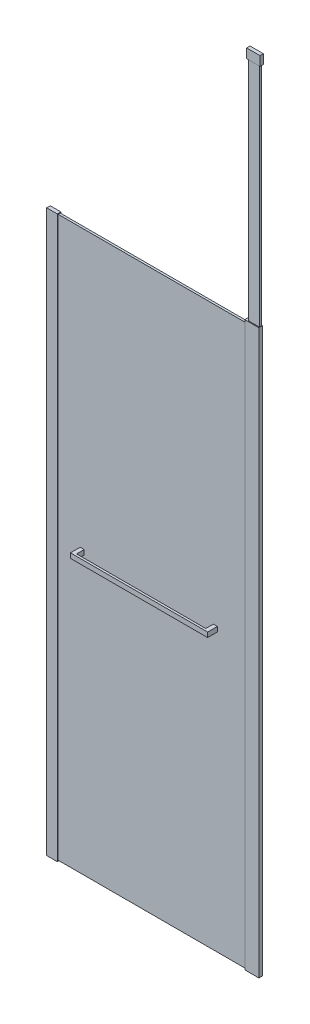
SolidWorks part; units mm, degrees
ref_plane "Płaszczyzna przednia" through (0, 0, 0) normal (0, 0, 1) x (1, 0, 0)
ref_plane "Płaszczyzna górna" through (0, 0, 0) normal (0, 1, 0) x (1, 0, 0)
ref_plane "Płaszczyzna prawa" through (0, 0, 0) normal (1, 0, 0) x (0, 0, -1)
sketch "Szkic1" plane through (0, 0, 0) normal (0, 1, 0) x (1, 0, 0)
  line L0 (0, 0) -> (0, 13.3)
  line L1 (0, 13.3) -> (40, 13.3)
  line L2 (40, 13.3) -> (40, 11.4)
  line L3 (40, 11.4) -> (6.5, 11.4)
  line L4 (6.5, 11.4) -> (6.5, 3.4)
  line L5 (6.5, 3.4) -> (40, 3.4)
  line L6 (40, 3.4) -> (40, 0)
  line L7 (40, 0) -> (0, 0)
  dimension "D1" = 40
  dimension "D2" = 13.3
  dimension "D3" = 33.5
  dimension "D4" = 1.9
  dimension "D5" = 8
extrude "Dodanie-wyciągnięcie1" add sketch "Szkic1" along normal blind 2100 from offset 3
sketch "Szkic2" plane through (0, 3, 0) normal (0, -1, 0) x (1, 0, 0)
  line L0 (6.5, -11.4) -> (40, -11.4) construction
  line L1 (6.5, -3.4) -> (753.5, -3.4)
  line L2 (6.5, -3.4) -> (6.5, -11.4)
  line L3 (6.5, -11.4) -> (753.5, -11.4)
  line L4 (753.5, -3.4) -> (753.5, -11.4)
  dimension "D1" = 747
extrude "Dodanie-wyciągnięcie2" add sketch "Szkic2" against normal blind 2100 separate body
sketch "Szkic3" plane through (0, 3, 0) normal (0, -1, 0) x (1, 0, 0)
  line L0 (743.4, -3.4) -> (743.4, -0.4)
  line L1 (753.5, -3.4) -> (6.5, -3.4) construction
  line L2 (743.4, -0.4) -> (796.4, -0.4)
  line L3 (796.4, -0.4) -> (796.4, -14.4)
  line L4 (796.4, -14.4) -> (743.4, -14.4)
  line L5 (743.4, -14.4) -> (743.4, -11.4)
  line L6 (743.4, -11.4) -> (753.5, -11.4)
  line L7 (753.5, -11.4) -> (753.5, -3.4)
  line L8 (753.5, -3.4) -> (743.4, -3.4)
  line L9 (6.5, -11.4) -> (753.5, -11.4) construction
  line L10 (753.5, -11.4) -> (753.5, -3.4) construction
  dimension "D1" = 10.1
  dimension "D2" = 3
  dimension "D3" = 3
  dimension "D4" = 53
extrude "Dodanie-wyciągnięcie3" add sketch "Szkic3" against normal blind 2108 separate body
sketch "Szkic4" plane through (0, 2103, 0) normal (0, 1, 0) x (1, 0, 0)
  line L1 (0, 13.3) -> (40, 13.3)
  line L2 (0, 13.3) -> (0, 0)
  line L3 (0, 0) -> (40, 0)
  line L4 (40, 13.3) -> (40, 0)
extrude "Dodanie-wyciągnięcie4" add sketch "Szkic4" along normal blind 3
sketch "Szkic5" plane through (0, 2111, 0) normal (0, 1, 0) x (1, 0, 0)
  line L1 (796.4, 14.4) -> (743.4, 14.4)
  line L2 (796.4, 14.4) -> (796.4, 0.4)
  line L3 (796.4, 0.4) -> (743.4, 0.4)
  line L4 (743.4, 14.4) -> (743.4, 0.4)
extrude "Dodanie-wyciągnięcie5" add sketch "Szkic5" along normal blind 3
sketch "Szkic6" plane through (743.4, 0, 0) normal (-1, 0, 0) x (0, 0, 1)
  line L0 (-11.4, 2111) -> (-3.4, 2111) construction
  line L1 (-3.35, 2111) -> (-11.45, 2111)
  line L2 (-3.35, 2111) -> (-3.35, 2103.2)
  line L3 (-3.35, 2103.2) -> (-11.45, 2103.2)
  line L4 (-11.45, 2111) -> (-11.45, 2103.2)
  point P6 (-7.4, 2111)
  dimension "D1" = 8.1
  dimension "D2" = 7.8
extrude "Dodanie-wyciągnięcie6" add sketch "Szkic6" against normal blind 15
sketch "Szkic7" plane through (0, 3, 0) normal (0, -1, 0) x (1, 0, 0)
  line L1 (743.4, -0.4) -> (796.4, -0.4)
  line L2 (743.4, -0.4) -> (743.4, -14.4)
  line L3 (743.4, -14.4) -> (796.4, -14.4)
  line L4 (796.4, -0.4) -> (796.4, -14.4)
extrude "Dodanie-wyciągnięcie7" add sketch "Szkic7" along normal blind 3
sketch "Szkic8" plane through (0, 3, 0) normal (0, -1, 0) x (1, 0, 0)
  line L1 (0, 0) -> (40, 0)
  line L2 (0, 0) -> (0, -13.3)
  line L3 (0, -13.3) -> (40, -13.3)
  line L4 (40, 0) -> (40, -13.3)
extrude "Dodanie-wyciągnięcie8" add sketch "Szkic8" along normal blind 3
sketch "Szkic9" plane through (0, 2114, 2099.6) normal (0, -1, 0) x (-1, 0, 0)
  line L1 (-794.9, 2111) -> (-754.9, 2111)
  line L2 (-794.9, 2111) -> (-794.9, 2103)
  line L3 (-794.9, 2103) -> (-754.9, 2103)
  line L4 (-754.9, 2111) -> (-754.9, 2103)
  line L7 (-743.4, 2114) -> (-796.4, 2114) construction
  line L8 (-796.4, 2114) -> (-796.4, 2100) construction
  dimension "D1" = 3
  dimension "D2" = 1.5
  dimension "D3" = 8
  dimension "D4" = 40
extrude "Dodanie-wyciągnięcie9" add sketch "Szkic9" against normal blind 883 separate body
sketch "Szkic10" plane through (0, 2997, 0) normal (0, 1, 0) x (-1, 0, 0)
  line L0 (-774.9, -11.4) -> (-774.9, -7.4) construction
  line L1 (-799.9, -1.15) -> (-749.9, -1.15)
  line L2 (-799.9, -1.15) -> (-799.9, -13.65)
  line L3 (-799.9, -13.65) -> (-749.9, -13.65)
  line L4 (-749.9, -1.15) -> (-749.9, -13.65)
  line L5 (-799.9, -1.15) -> (-749.9, -13.65) construction
  line L6 (-799.9, -13.65) -> (-749.9, -1.15) construction
  line L7 (-754.9, -11.4) -> (-794.9, -11.4) construction
  line L8 (-774.9, -7.4) -> (-794.9, -7.4) construction
  line L9 (-794.9, -11.4) -> (-794.9, -3.4) construction
  point P0 (-774.9, -7.4)
  dimension "D1" = 12.5
  dimension "D2" = 50
extrude "Dodanie-wyciągnięcie10" add sketch "Szkic10" along normal blind 35 from offset 32
ref_plane "Płaszczyzna1" through (774.9, 0, 0) normal (1, 0, 0) x (0, 0, -1)
sketch "Szkic12" plane through (0, 0, -3.4) normal (0, 0, 1) x (1, 0, 0)
  line L0 (380, 1409.7928) -> (380, 762.3594) construction
  line L1 (130, 1053) -> (630, 1053) construction
  line L2 (6.5, 2103) -> (6.5, 3) construction
  line L3 (753.5, 2103) -> (753.5, 3) construction
  line L5 (122.5, 1062) -> (137.5, 1062)
  line L6 (122.5, 1062) -> (122.5, 1044)
  line L7 (122.5, 1044) -> (137.5, 1044)
  line L8 (137.5, 1062) -> (137.5, 1044)
  line L9 (122.5, 1062) -> (137.5, 1044) construction
  line L10 (122.5, 1044) -> (137.5, 1062) construction
  line L11 (622.5, 1062) -> (637.5, 1062)
  line L12 (622.5, 1062) -> (622.5, 1044)
  line L13 (622.5, 1044) -> (637.5, 1044)
  line L14 (637.5, 1062) -> (637.5, 1044)
  line L15 (622.5, 1062) -> (637.5, 1044) construction
  line L16 (622.5, 1044) -> (637.5, 1062) construction
  dimension "D1" = 1053
  dimension "D2" = 500
  dimension "D3" = 15
  dimension "D4" = 18
extrude "Dodanie-wyciągnięcie11" add sketch "Szkic12" along normal blind 36.5 and the other way blind 18 separate body
sketch "Szkic13" plane through (137.5, 0, 0) normal (1, 0, 0) x (0, 0, -1)
  line L0 (21.4, 1044) -> (-33.1, 1044) construction
  line L1 (-33.1, 1062) -> (-25.1, 1062)
  line L2 (-33.1, 1062) -> (-33.1, 1044)
  line L3 (-33.1, 1044) -> (-25.1, 1044)
  line L4 (-25.1, 1062) -> (-25.1, 1044)
  dimension "D1" = 8
extrude "Dodanie-wyciągnięcie12" add sketch "Szkic13" along normal up to surface (485 mm away)
